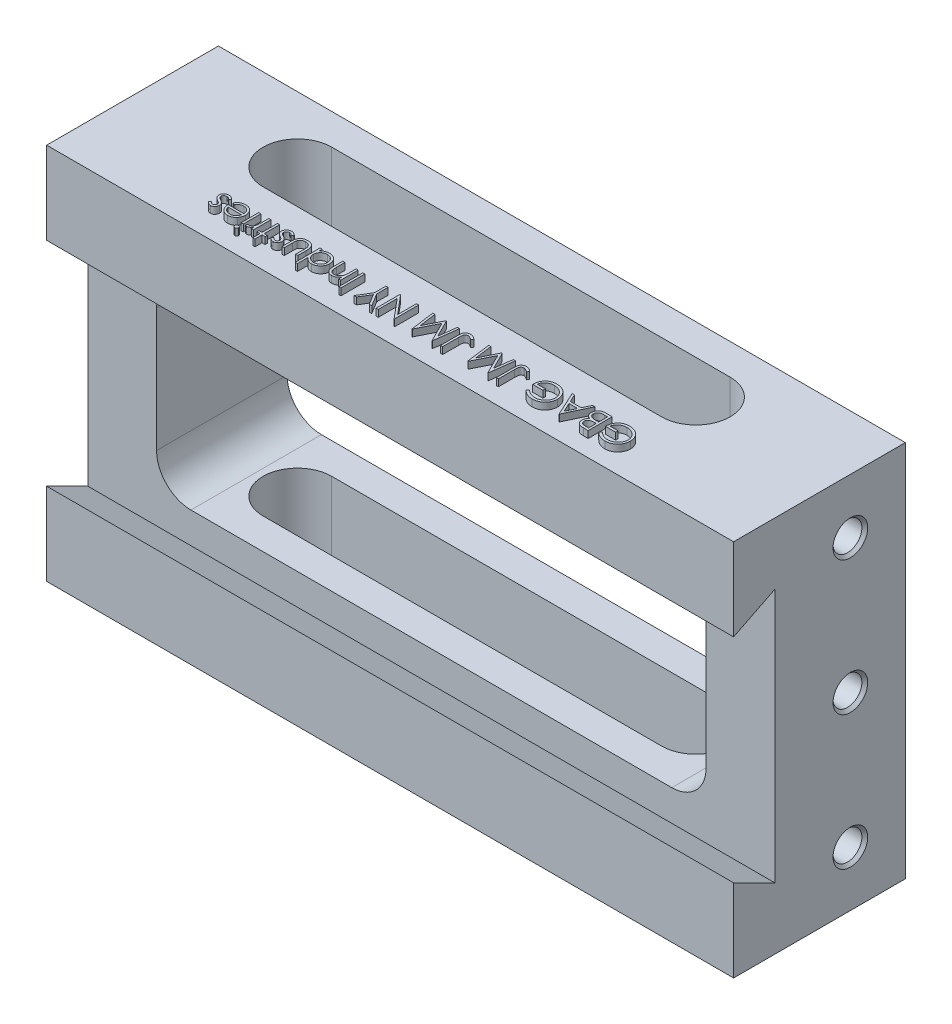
SolidWorks part; units mm, degrees
ref_plane "Front Plane" through (0, 0, 0) normal (0, 0, 1) x (1, 0, 0)
ref_plane "Top Plane" through (0, 0, 0) normal (0, 1, 0) x (1, 0, 0)
ref_plane "Right Plane" through (0, 0, 0) normal (1, 0, 0) x (0, 0, -1)
sketch "Sketch2" plane through (0, 0, 0) normal (0, 0, 1) x (1, 0, 0)
  line L1 (-50, -27.5) -> (50, -27.5)
  line L2 (-50, -27.5) -> (-50, 27.5)
  line L3 (-50, 27.5) -> (50, 27.5)
  line L4 (50, -27.5) -> (50, 27.5)
  line L5 (-50, -27.5) -> (50, 27.5) construction
  line L6 (-50, 27.5) -> (50, -27.5) construction
  line L7 (-35, -14) -> (35, -14)
  line L8 (-40, -9) -> (-40, 9)
  line L9 (-35, 14) -> (35, 14)
  line L10 (40, -9) -> (40, 9)
  line L11 (-40, -14) -> (40, 14) construction
  line L12 (-40, 14) -> (40, -14) construction
  arc A0 (35, -14) -> (40, -9) centre (35, -9) ccw
  arc A1 (35, 14) -> (40, 9) centre (35, 9) cw
  arc A2 (-35, -14) -> (-40, -9) centre (-35, -9) cw
  arc A3 (-40, 9) -> (-35, 14) centre (-35, 9) cw
  point P0 (0, 0)
  point P6 (0, 0)
  dimension "D5" = 5
  dimension "D1" = 100
  dimension "D2" = 55
  dimension "D3" = 80
  dimension "D4" = 28
extrude "Boss-Extrude1" add sketch "Sketch2" along normal blind 25
sketch "Sketch3" plane through (0, -27.5, 0) normal (0, -1, 0) x (1, 0, 0)
  line L0 (0, 0) -> (0, 25) construction
  line L1 (-50, 25) -> (50, 25) construction
  line L2 (0, 9.5) -> (-31.2324, 9.5) construction
  line L3 (-50, 0) -> (50, 0) construction
  line L4 (-29, 9.5) -> (29, 9.5) construction
  line L5 (-29, 14.5) -> (29, 14.5)
  line L6 (-29, 4.5) -> (29, 4.5)
  arc A0 (-29, 14.5) -> (-29, 4.5) centre (-29, 9.5) ccw
  arc A1 (29, 4.5) -> (29, 14.5) centre (29, 9.5) ccw
  point P11 (0, 9.5)
  dimension "D3" = 5
  dimension "D1" = 9.5
  dimension "D2" = 58
extrude "Cut-Extrude1" cut sketch "Sketch3" against normal through all both and the other way through all
sketch "Sketch4" plane through (50, 0, 0) normal (1, 0, 0) x (0, 0, -1)
  line L1 (-25, -27.5) -> (-25, 27.5) construction
  line L2 (-25, -15.5) -> (-19, -18.5)
  line L3 (-25, -27.5) -> (0, -27.5) construction
  line L4 (0, 0) -> (-25, 0) construction
  line L5 (-25, 15.5) -> (-19, 18.5)
  line L7 (-19, -18.5) -> (-19, 18.5)
  line L8 (-25, -15.5) -> (-25, 15.5)
  dimension "D1" = 31
  dimension "D2" = 6
  dimension "D3" = 9
extrude "Cut-Extrude2" cut sketch "Sketch4" against normal through all both and the other way through all
sketch "Sketch5" plane through (-50, 0, 0) normal (-1, 0, 0) x (0, 0, 1)
  line L0 (25, 27.5) -> (0, 27.5) construction
  line L1 (0, 27.5) -> (0, -27.5) construction
  line L2 (25, -27.5) -> (0, -27.5) construction
  point P0 (8, 19.5)
  point P5 (8, -19.5)
  point P8 (8, 0)
  dimension "D1" = 8
  dimension "D2" = 8
  dimension "D3" = 8
  dimension "D4" = 8
  dimension "D5" = 19.5
  dimension "D6" = 8
hole_wizard "M5x0.8 Tapped Hole1" positions "3DSketch1" profile "Sketch6" tap size "M5x0.8" standard "ANSI Metric"
sketch3d "3DSketch1"
  point P0 (-50, 19.5, 8)
  point P3 (-50, 0, 8)
  point P6 (-50, -19.5, 8)
sketch "Sketch6" plane through (-50, 19.5, 8) normal (0, 1, 0) x (0, 0, 1)
  line L0 (0, 0) -> (0, 8.4618)
  line L1 (0, 8.4618) -> (2.1, 7.2)
  line L2 (2.1, 7.2) -> (2.1, 0.425)
  line L3 (2.1, 0.425) -> (2.525, 0)
  line L5 (2.525, 0) -> (0, 0)
  line L6 (-2.1, 0.425) -> (-2.525, 0) construction
  line L10 (0, 8.4618) -> (-2.1, 7.2) construction
  line L11 (0, -6.35) -> (0, 107.95) construction
  dimension "Tap Drill Dia." = 4.2
  dimension "Tap Drill Depth" = 7.2
  dimension "Near C'Sink Dia." = 5.05
  dimension "Near C'Sink Angle" = 90
  dimension "Drill Angle" = 118
mirror "Mirror1" about plane through (0, 0, 0) normal (1, 0, 0) of "M5x0.8 Tapped Hole1"
sketch "Sketch9" plane through (0, 27.5, 0) normal (0, 1, 0) x (1, 0, 0)
  line L0 (31.0691, -19.073) -> (-29.1118, -19.073) construction
  text T0 "GBAG JM JM NY Industries"
extrude "Boss-Extrude2" add sketch "Sketch9" along normal blind 1
